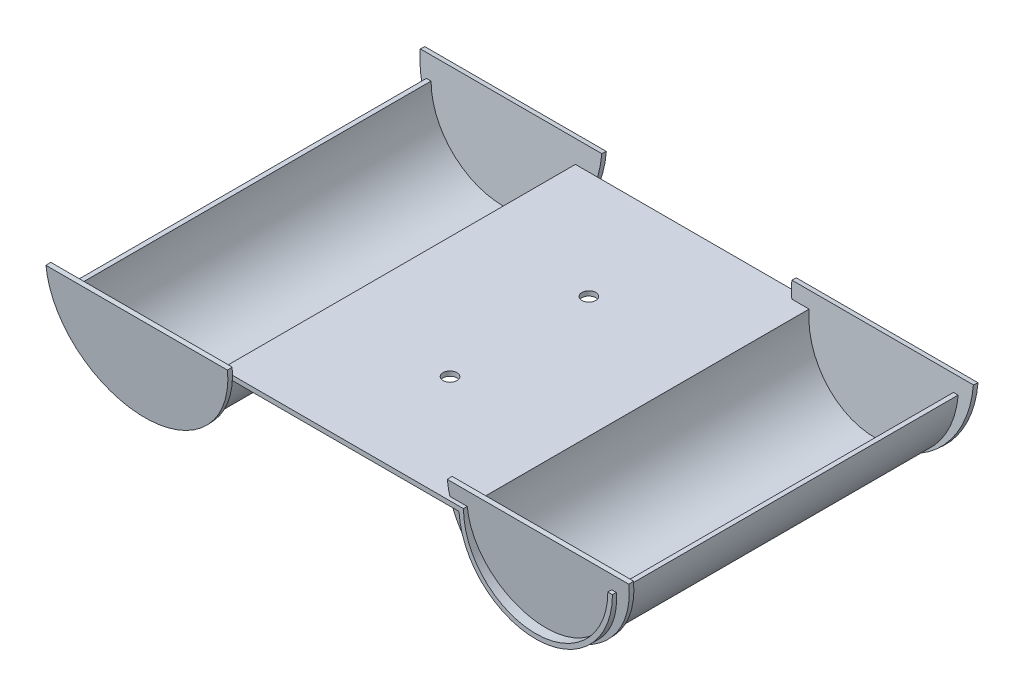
SolidWorks part; units mm, degrees
ref_plane "Alzado" through (0, 0, 0) normal (0, 0, 1) x (1, 0, 0)
ref_plane "Planta" through (0, 0, 0) normal (0, 1, 0) x (1, 0, 0)
ref_plane "Vista lateral" through (0, 0, 0) normal (1, 0, 0) x (0, 0, -1)
sketch "Croquis1" plane through (0, 0, 0) normal (0, 0, 1) x (1, 0, 0)
  line L0 (55, 0) -> (-55, 0) construction
  line L1 (0, -55) -> (0, 55) construction
  line L2 (-114.6856, 0) -> (-116.6856, 0)
  line L3 (-52.3144, 0) -> (52.3144, 0)
  line L4 (-50.3747, -2) -> (50.3747, -2)
  line L7 (114.6856, 0) -> (116.6856, 0)
  arc A0 (-52.3144, 0) -> (-114.6856, 0) centre (-83.5, 0) cw
  arc A1 (-50.3747, -2) -> (-116.6856, 0) centre (-83.5, 0) cw
  arc A2 (52.3144, 0) -> (114.6856, 0) centre (83.5, 0) ccw
  arc A3 (50.3747, -2) -> (116.6856, 0) centre (83.5, 0) ccw
  arc A4 (-50.3144, 0) -> (-116.6856, 0) centre (-83.5, 0) cw construction
  arc A5 (50.3144, 0) -> (116.6856, 0) centre (83.5, 0) ccw construction
  dimension "D1" = 83.5
  dimension "D3" = 2
  dimension "D4" = 167
  dimension "D5" = 2
  dimension "D2" = 2
extrude "Extruir1" add sketch "Croquis1" along normal mid plane 153
ref_plane "Plano1" through (-83.5, 0, 0) normal (1, 0, 0) x (0, 0, -1)
sketch "Croquis4" plane through (-83.5, 0, 0) normal (1, 0, 0) x (0, 0, -1)
  line L0 (-76.4324, -32.7008) -> (-78.4248, -32.8752)
  line L1 (-78.4248, -32.8752) -> (-81.8431, 6.1958)
  line L2 (-81.8431, 6.1958) -> (-79.8507, 6.3701)
  line L3 (-79.8507, 6.3701) -> (-76.4324, -32.7008)
  dimension "D1" = 2
revolve "Revolución3" add sketch "Croquis4" angle 180 about L2
mirror "Simetría1" about plane through (0, 0, 0) normal (0, 0, 1) of "Revolución3"
ref_plane "Plano2" through (83.5, 0, 0) normal (1, 0, 0) x (0, 0, -1)
sketch "Croquis11" plane through (83.5, 0, 0) normal (1, 0, 0) x (0, 0, -1)
  line L0 (-70, -32.5259) -> (-71.9924, -32.7003)
  line L1 (-71.9924, -32.7003) -> (-75.4107, 6.3707)
  line L2 (-75.4107, 6.3707) -> (-73.4183, 6.545)
  line L3 (-73.4183, 6.545) -> (-70, -32.5259)
  line L4 (0, -35.7257) -> (0, 40.7541) construction
  line L5 (0, 42.0639) -> (0, -42.0639) construction
  dimension "D1" = 70
revolve "Revolución4" add sketch "Croquis11" angle 180 about L2
mirror "Simetría2" about plane through (0, 0, 0) normal (0, 0, 1) of "Revolución4"
sketch "Croquis12" plane through (0, 0, 0) normal (0, 1, 0) x (-1, 0, 0)
  line L0 (0, 21.8518) -> (0, -21.8518) construction
  line L1 (21.8518, 0) -> (-21.8518, 0) construction
  circle A0 centre (0, 30) radius 3
  circle A1 centre (0, -30) radius 3
  dimension "D1" = 60
  dimension "D2" = 30
extrude "Cortar-Extruir1" cut sketch "Croquis12" against normal up to next
